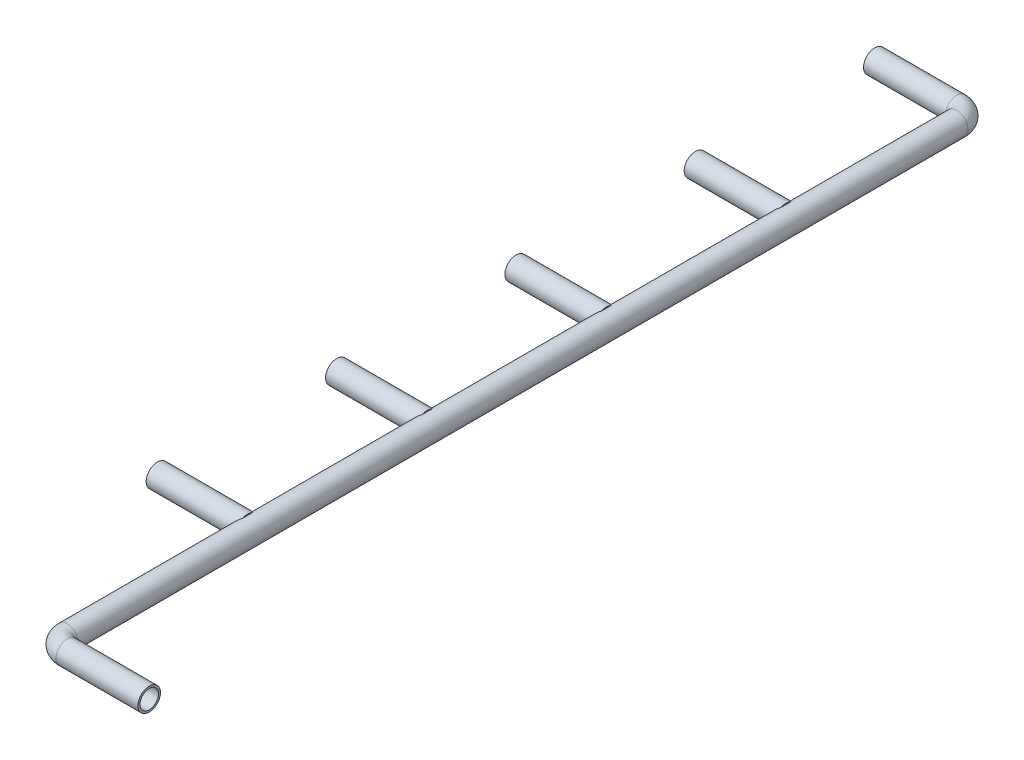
SolidWorks part; units mm, degrees
ref_plane "Front Plane" through (0, 0, 0) normal (0, 0, 1) x (1, 0, 0)
ref_plane "Top Plane" through (0, 0, 0) normal (0, 1, 0) x (1, 0, 0)
ref_plane "Right Plane" through (0, 0, 0) normal (1, 0, 0) x (0, 0, -1)
sketch "Schizzo2" plane through (0, 0, 0) normal (1, 0, 0) x (0, 0, -1)
  circle A0 centre (0, 0) radius 5.5
  circle A1 centre (-87.5, 0) radius 5.5
  circle A2 centre (-175, 0) radius 5.5
  circle A3 centre (-262.5, 0) radius 5.5
  circle A4 centre (-350, 0) radius 5.5
  circle A5 centre (0, 0) radius 4.5
  circle A6 centre (-87.5, 0) radius 4.5
  circle A7 centre (-175, 0) radius 4.5
  circle A8 centre (-262.5, 0) radius 4.5
  circle A9 centre (-350, 0) radius 4.5
  dimension "D1" = 11
  dimension "D2" = 11
  dimension "D3" = 11
  dimension "D4" = 11
  dimension "D5" = 11
  dimension "D11" = 9
  dimension "D12" = 9
  dimension "D13" = 9
  dimension "D14" = 9
  dimension "D15" = 9
  dimension "D6" = 350
  dimension "D7" = 87.5
  dimension "D8" = 87.5
  dimension "D9" = 87.5
  dimension "D10" = 87.5
extrude "Estrusione-Estrusione1" add sketch "Schizzo2" against normal blind 40
sketch "Schizzo3" plane through (0, 0, 0) normal (1, 0, 0) x (0, 0, -1)
  line L0 (-6.36, 6.0549) -> (-6.36, -6.5183) construction
  circle A0 centre (0, 0) radius 5.5
  circle A1 centre (0, 0) radius 4.5
revolve "Rivoluzione1" add sketch "Schizzo3" angle 90 about L0
sketch "Schizzo4" plane through (0, 0, 6.36) normal (0, 0, 1) x (1, 0, 0)
  circle A0 centre (6.36, 0) radius 5.5
  circle A1 centre (6.36, 0) radius 4.5
extrude "Estrusione-Estrusione2" add sketch "Schizzo4" along normal blind 434
sketch "Schizzo5" plane through (0, 0, 0) normal (1, 0, 0) x (0, 0, -1)
  circle A0 centre (-87.5, 0) radius 5.5
  circle A1 centre (-175, 0) radius 5.5
  circle A2 centre (-262.5, 0) radius 5.5
  circle A3 centre (-350, 0) radius 5.5
  circle A4 centre (-87.5, 0) radius 4.5
  circle A5 centre (-175, 0) radius 4.5
  circle A6 centre (-262.5, 0) radius 4.5
  circle A7 centre (-350, 0) radius 4.5
  dimension "D1" = 9
  dimension "D2" = 9
  dimension "D3" = 9
  dimension "D4" = 9
extrude "Estrusione-Estrusione3" add sketch "Schizzo5" along normal blind 4
sketch "Schizzo6" plane through (0, 0, 440.36) normal (0, 0, 1) x (1, 0, 0)
  line L0 (12.6994, 5.5) -> (12.6994, -6.058) construction
  circle A0 centre (6.36, 0) radius 4.5
  circle A1 centre (6.36, 0) radius 5.5
revolve "Rivoluzione2" add sketch "Schizzo6" angle 90 about L0
sketch "Schizzo7" plane through (12.6994, 0, 0) normal (1, 0, 0) x (0, 0, -1)
  circle A0 centre (-446.6994, 0) radius 4.5
  circle A1 centre (-446.6994, 0) radius 5.5
extrude "Estrusione-Estrusione4" add sketch "Schizzo7" along normal blind 40
